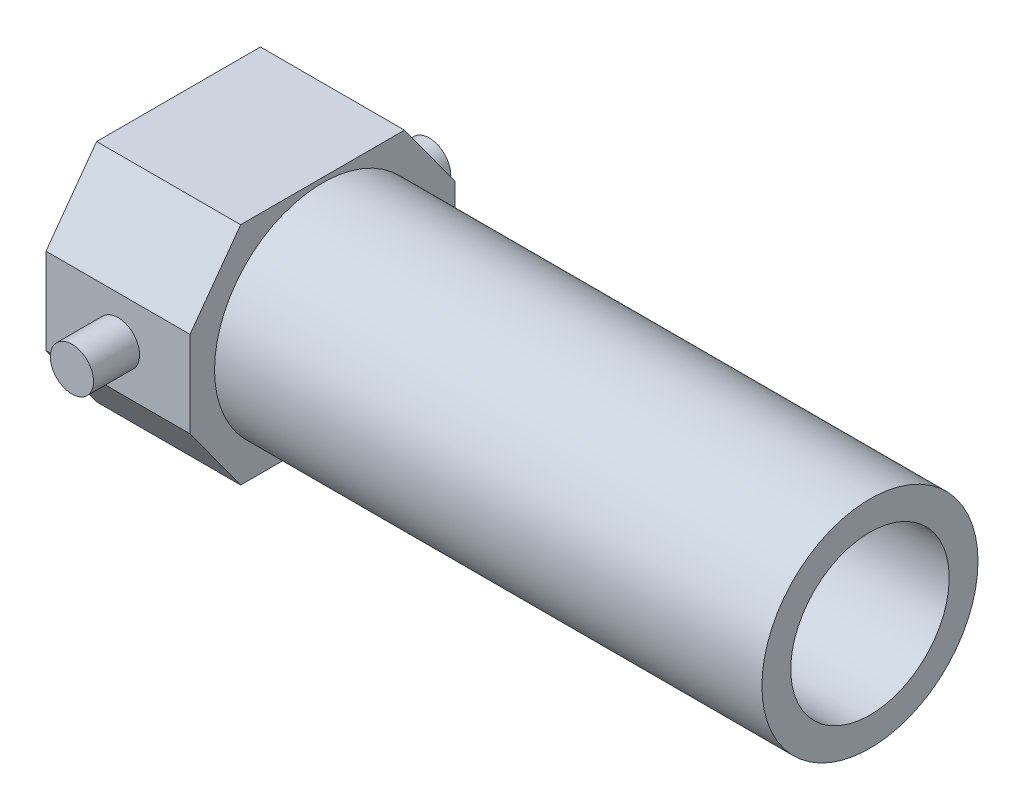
SolidWorks part; units mm, degrees
ref_plane "Front" through (0, 0, 0) normal (0, 0, 1) x (1, 0, 0)
ref_plane "Top" through (0, 0, 0) normal (0, 1, 0) x (1, 0, 0)
ref_plane "Right" through (0, 0, 0) normal (1, 0, 0) x (0, 0, -1)
imported_body "Imported1"
other "Move Face1"
